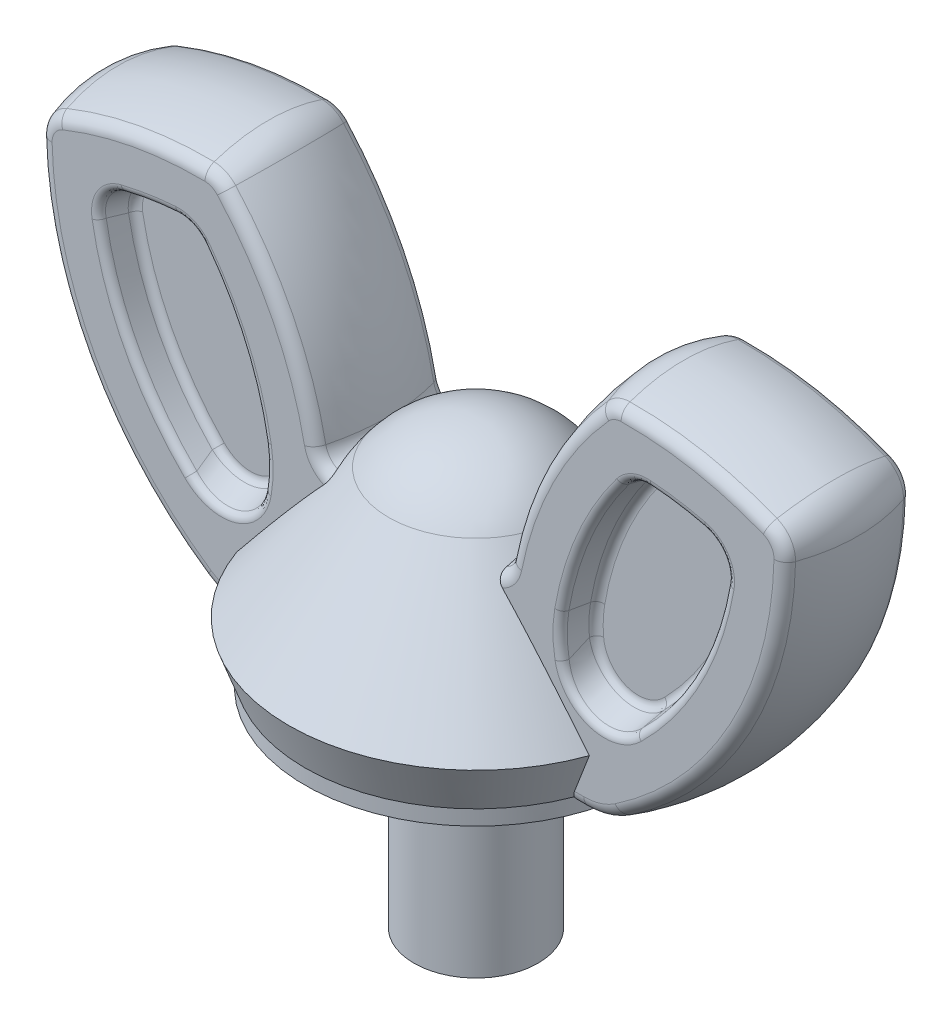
SolidWorks part; units mm, degrees
ref_plane "Front Plane" through (0, 0, 0) normal (0, 0, 1) x (1, 0, 0)
ref_plane "Top Plane" through (0, 0, 0) normal (0, 1, 0) x (1, 0, 0)
ref_plane "Right Plane" through (0, 0, 0) normal (1, 0, 0) x (0, 0, -1)
sketch "Sketch1" plane through (0, 0, 0) normal (0, 0, 1) x (1, 0, 0)
  line L0 (0, 10.7344) -> (0, 0) construction
  line L5 (4.826, 0) -> (-4.826, 0)
  line L6 (2.413, 5.08) -> (-2.413, 5.08)
  arc A11 (-2.413, 5.08) -> (-5.3975, 10.9034) centre (-13.1787, 3.2391) ccw
  arc A13 (-5.3975, 10.9034) -> (-10.795, 9.8298) centre (-6.0342, 0) ccw
  arc A24 (-10.795, 9.8298) -> (-6.0486, 0.3742) centre (0, 9.3295) ccw
  arc A26 (-4.826, 0) -> (-6.0486, 0.3742) centre (-4.826, 2.1844) cw
  arc A29 (4.826, 0) -> (6.0486, 0.3742) centre (4.826, 2.1844) ccw
  arc A34 (10.795, 9.8298) -> (6.0486, 0.3742) centre (0, 9.3295) cw
  arc A36 (5.3975, 10.9034) -> (10.795, 9.8298) centre (6.0342, 0) cw
  arc A37 (2.413, 5.08) -> (5.3975, 10.9034) centre (13.1787, 3.2391) cw
  point P19 (0, 0)
  point P27 (0, 5.08)
  point P29 (0, 5.08)
  point P44 (0, 5.08)
extrude "Extrude1" add sketch "Sketch1" along normal mid plane 3.556
fillet "Fillet4" radius 1.0922 4 edges at (10.795, 9.8298, 0) (5.3975, 10.9034, 0) (-5.3975, 10.9034, 0) (-10.795, 9.8298, 0)
sketch "Sketch2" plane through (0, 0, 1.778) normal (0, 0, 1) x (1, 0, 0)
  line L0 (0, 0) -> (0, 12.8329) construction
  line L1 (-4.826, 0) -> (4.826, 0) construction
  arc A10 (-4.1864, 4.7767) -> (-5.0416, 1.8652) centre (-7.5893, 4.1949) cw
  arc A11 (4.1864, 4.7767) -> (6.2055, 9.1212) centre (13.1787, 3.2391) cw
  arc A12 (6.2055, 9.1212) -> (8.9805, 8.634) centre (6.0342, 0) cw
  arc A13 (8.9805, 8.634) -> (5.0416, 1.8652) centre (0, 9.3295) cw
  arc A14 (4.1864, 4.7767) -> (5.0416, 1.8652) centre (7.5893, 4.1949) ccw
  arc A15 (-8.9805, 8.634) -> (-5.0416, 1.8652) centre (0, 9.3295) ccw
  arc A16 (-6.2055, 9.1212) -> (-8.9805, 8.634) centre (-6.0342, 0) ccw
  arc A17 (-4.1864, 4.7767) -> (-6.2055, 9.1212) centre (-13.1787, 3.2391) ccw
  arc A18 (-8.9805, 8.634) -> (-5.0416, 1.8652) centre (0, 9.3295) ccw
  arc A19 (-6.2055, 9.1212) -> (-8.9805, 8.634) centre (-6.0342, 0) ccw
  arc A20 (-4.1864, 4.7767) -> (-6.2055, 9.1212) centre (-13.1787, 3.2391) ccw
extrude "Cut-Extrude1" cut sketch "Sketch2" against normal blind 0.889 draft 10
fillet "Fillet1" radius 0.889 4 edges
fillet "Fillet6" radius 1.2446 2 edges
fillet "Fillet5" radius 0.3641 2 edges at (2.413, 5.08, 0) (-2.413, 5.08, 0)
fillet "Fillet3" radius 0.2223 28 edges at (7.4585, 9.011, 1.778) (7.4007, 8.8613, 0.889) (6.4621, 8.9114, 0.889) (8.6146, 8.3041, 0.889) (7.8855, 5.3103, 0.889) (4.2988, 4.3764, 0.889) (6.1282, 8.9579, 1.778) (8.7221, 8.5339, 1.778) (7.9776, 5.1471, 1.778) (4.1377, 4.1292, 1.778) (-4.2988, 4.3764, 0.889) (-7.8855, 5.3103, 0.889) (-8.5332, 8.4279, 0.889) (-7.4007, 8.8613, 0.889) (-6.1942, 8.7899, 0.889) (-4.1377, 4.1292, 1.778) (-7.9776, 5.1471, 1.778) (-8.7866, 8.4358, 1.778) (-7.4585, 9.011, 1.778) (-6.3795, 9.0717, 1.778) (4.9351, 6.7652, 0.889) (4.81, 6.8709, 1.778) (-4.9351, 6.7652, 0.889) (-4.81, 6.8709, 1.778) (4.9742, 2.938, 0.889) (5.0791, 2.5366, 1.778) (-5.2102, 2.8514, 0.889) (-5.0131, 2.5568, 1.778)
mirror "Mirror1" about plane through (0, 0, 0) normal (0, 0, 1) of "Fillet6", "Fillet3", "Fillet1", "Cut-Extrude1"
sketch "Sketch4" plane through (0, 0, 0) normal (1, 0, 0) x (0, 0, -1)
  line L1 (-1.778, 5.334) -> (1.778, 5.334)
  line L2 (-1.778, 4.4704) -> (-1.778, 5.334)
  line L4 (1.778, 0.3742) -> (1.778, 9.0918) construction
  line L6 (-1.778, 9.0918) -> (-1.778, 0.3742) construction
  line L7 (0, 5.715) -> (0, 0.381) construction
  line L9 (1.778, 4.4704) -> (1.778, 5.334)
  line L10 (-1.778, 5.08) -> (1.778, 5.08) construction
  arc A0 (-1.524, 4.826) -> (-1.778, 4.4704) centre (-1.4021, 4.4704) ccw
  arc A1 (1.524, 4.826) -> (-1.524, 4.826) centre (0, 0.381) ccw
  arc A2 (1.524, 4.826) -> (1.778, 4.4704) centre (1.4021, 4.4704) cw
  point P8 (0, 5.08)
sketch3d "3DSketch1"
  line L2 (-2.1102, 5.08, 1.778) -> (2.1102, 5.08, 1.778)
  line L3 (4.826, 0, 1.778) -> (-4.826, 0, 1.778)
  line L4 (-2.1102, 5.08, 1.778) -> (2.1102, 5.08, 1.778)
  line L5 (4.826, 0, 1.778) -> (-4.826, 0, 1.778)
  arc A15 (10.804, 9.0918, 1.778) -> (6.0486, 0.3742, 1.778) centre (0, 9.3295, 1.778) ccw
  arc A16 (10.1207, 10.1287, 1.778) -> (10.804, 9.0918, 1.778) centre (9.712, 9.1158, 1.778) ccw
  arc A17 (5.8682, 10.9207, 1.778) -> (10.1207, 10.1287, 1.778) centre (6.0342, 0, 1.778) ccw
  arc A18 (5.0743, 10.5608, 1.778) -> (5.8682, 10.9207, 1.778) centre (5.8848, 9.8287, 1.778) ccw
  arc A19 (2.4672, 5.3729, 1.778) -> (5.0743, 10.5608, 1.778) centre (13.1787, 3.2391, 1.778) ccw
  arc A20 (2.1102, 5.08, 1.778) -> (2.4672, 5.3729, 1.778) centre (2.1102, 5.4441, 1.778) ccw
  arc A21 (2.1102, 5.08, 1.778) -> (2.4672, 5.3729, 1.778) centre (2.1102, 5.4441, 1.778) ccw
  arc A22 (-5.0743, 10.5608, 1.778) -> (-2.4672, 5.3729, 1.778) centre (-13.1787, 3.2391, 1.778) ccw
  arc A23 (-5.8682, 10.9207, 1.778) -> (-5.0743, 10.5608, 1.778) centre (-5.8848, 9.8287, 1.778) ccw
  arc A24 (-10.1207, 10.1287, 1.778) -> (-5.8682, 10.9207, 1.778) centre (-6.0342, 0, 1.778) ccw
  arc A25 (-10.804, 9.0918, 1.778) -> (-10.1207, 10.1287, 1.778) centre (-9.712, 9.1158, 1.778) ccw
  arc A26 (-6.0486, 0.3742, 1.778) -> (-10.804, 9.0918, 1.778) centre (0, 9.3295, 1.778) ccw
  arc A27 (-4.826, 0, 1.778) -> (-6.0486, 0.3742, 1.778) centre (-4.826, 2.1844, 1.778) ccw
  arc A28 (6.0486, 0.3742, 1.778) -> (4.826, 0, 1.778) centre (4.826, 2.1844, 1.778) ccw
  arc A29 (10.804, 9.0918, 1.778) -> (6.0486, 0.3742, 1.778) centre (0, 9.3295, 1.778) ccw
  arc A30 (10.1207, 10.1287, 1.778) -> (10.804, 9.0918, 1.778) centre (9.712, 9.1158, 1.778) ccw
  arc A31 (5.8682, 10.9207, 1.778) -> (10.1207, 10.1287, 1.778) centre (6.0342, 0, 1.778) ccw
  arc A32 (5.0743, 10.5608, 1.778) -> (5.8682, 10.9207, 1.778) centre (5.8848, 9.8287, 1.778) ccw
  arc A33 (2.4672, 5.3729, 1.778) -> (5.0743, 10.5608, 1.778) centre (13.1787, 3.2391, 1.778) ccw
  arc A34 (-2.4672, 5.3729, 1.778) -> (-2.1102, 5.08, 1.778) centre (-2.1102, 5.4441, 1.778) ccw
  arc A35 (-2.4672, 5.3729, 1.778) -> (-2.1102, 5.08, 1.778) centre (-2.1102, 5.4441, 1.778) ccw
  arc A36 (-5.0743, 10.5608, 1.778) -> (-2.4672, 5.3729, 1.778) centre (-13.1787, 3.2391, 1.778) ccw
  arc A37 (-5.8682, 10.9207, 1.778) -> (-5.0743, 10.5608, 1.778) centre (-5.8848, 9.8287, 1.778) ccw
  arc A38 (-10.1207, 10.1287, 1.778) -> (-5.8682, 10.9207, 1.778) centre (-6.0342, 0, 1.778) ccw
  arc A39 (-10.804, 9.0918, 1.778) -> (-10.1207, 10.1287, 1.778) centre (-9.712, 9.1158, 1.778) ccw
  arc A40 (-6.0486, 0.3742, 1.778) -> (-10.804, 9.0918, 1.778) centre (0, 9.3295, 1.778) ccw
  arc A41 (-4.826, 0, 1.778) -> (-6.0486, 0.3742, 1.778) centre (-4.826, 2.1844, 1.778) ccw
  arc A42 (6.0486, 0.3742, 1.778) -> (4.826, 0, 1.778) centre (4.826, 2.1844, 1.778) ccw
  point P3 (2.1102, 5.4441, 2.1421)
  point P5 (2.1102, 5.4441, 2.1421)
  point P11 (-2.1102, 5.4441, 2.1421)
  point P13 (-2.1102, 5.4441, 2.1421)
  point P43 (0, 9.3295, -9.0286)
  point P46 (9.712, 9.1158, 0.6858)
  point P48 (6.0342, 0, -9.144)
  point P50 (5.8848, 9.8287, 0.6858)
  point P52 (13.1787, 3.2391, -9.144)
  point P58 (-13.1787, 3.2391, -9.144)
  point P60 (-5.8848, 9.8287, 0.6858)
  point P62 (-6.0342, 0, -9.144)
  point P64 (-9.712, 9.1158, 0.6858)
  point P66 (0, 9.3295, -9.0286)
  point P68 (-4.826, 2.1844, -0.4064)
  point P70 (4.826, 2.1844, -0.4064)
  point P71 (0, 9.3295, -9.0286)
  point P72 (9.712, 9.1158, 0.6858)
  point P73 (6.0342, 0, -9.144)
  point P74 (5.8848, 9.8287, 0.6858)
  point P75 (13.1787, 3.2391, -9.144)
  point P78 (-13.1787, 3.2391, -9.144)
  point P79 (-5.8848, 9.8287, 0.6858)
  point P80 (-6.0342, 0, -9.144)
  point P81 (-9.712, 9.1158, 0.6858)
  point P82 (0, 9.3295, -9.0286)
  point P83 (-4.826, 2.1844, -0.4064)
  point P84 (4.826, 2.1844, -0.4064)
  dimension "D1" = 0
sweep "Cut-Sweep2" cut profiles "Sketch4" path "3DSketch1"
sketch "Sketch3" plane through (0, 0, 0) normal (0, 0, 1) x (1, 0, 0)
  line L0 (0, 6.5903) -> (0, -11.3525) construction
  line L1 (1.7526, 0) -> (4.826, 0)
  line L2 (5.2882, 1.6933) -> (2.4672, 5.3729)
  line L4 (1.7526, 0) -> (1.7526, -6.35)
  line L5 (1.7526, -6.35) -> (0, -6.35)
  line L6 (4.826, 0) -> (4.826, 0.4233)
  line L7 (0, 6.5903) -> (0, -6.35)
  line L8 (0, 6.5903) -> (-2.4754, 6.5903) construction
  line L9 (4.826, 0.4233) -> (5.2882, 1.6933)
  arc A1 (2.4672, 5.3729) -> (0, 6.5903) centre (0, 3.4814) ccw
revolve "Revolve1" add sketch "Sketch3" angle 360 about L0
sketch "Sketch6" plane through (0, 0, 0) normal (0, 0, 1) x (1, 0, 0)
  line L0 (0, 4.5862) -> (0, -8.8633) construction
  line L2 (1.7526, -6.35) -> (1.7526, 0) construction
  line L3 (-1.7526, -6.35) -> (1.7526, -6.35) construction
  line L4 (1.7526, -5.8881) -> (2.0066, -5.8881)
  line L5 (2.0066, -5.8881) -> (2.0066, -6.604)
  line L8 (2.0066, -6.604) -> (0, -6.604)
  line L9 (0, -6.604) -> (0, -6.35)
  arc A0 (0, -6.35) -> (1.7526, -5.8881) centre (0, -2.794) ccw
  dimension "D1" = 0.254
  dimension "R" = 3.556
  dimension "D2" = 0.254
revolve "Cut-Revolve11" cut sketch "Sketch6" angle 360 about L0
sketch "Sketch5" plane through (0, 0, 0) normal (0, 0, 1) x (1, 0, 0)
  line L0 (1.7526, -0.0254) -> (1.2802, -0.2982)
  line L1 (1.2802, -0.2982) -> (1.7526, -0.5709)
  line L2 (1.7526, -0.5709) -> (1.7526, -0.0254)
  line L3 (0, 0) -> (0, -7.7715) construction
  line L6 (1.2802, -0.2982) -> (1.2802, -1.0906) construction
revolve "Cut-Revolve10" [suppressed] cut sketch "Sketch5" angle 360 about L3
pattern_linear "LPattern10" [suppressed] count 8 spacing 0.7925 along (0, -1, 0)
equation "\"D5@Sketch1\" = \"E@Sketch1\" / 2"
equation "\"D1@Sketch1\" = \"A@Sketch1\" / 4"
equation "\"D3@Sketch1\" = \"B@Sketch1\" * 9 /  10"
equation "\"D4@Sketch1\" = \"B@Sketch1\""
equation "\"D2@Sketch1\" = \"D4@Sketch1\" / 5"
equation "\"D1@Cut-Extrude1\" = \"C@Extrude1\" / 4"
equation "\"D1@Fillet1\" = \"D1@Cut-Extrude1\""
equation "\"D1@Fillet3\" = \"D1@Cut-Extrude1\" / 4"
equation "\"D2@Sketch3\" = \"G@Sketch1\" / 4"
equation "\"D3@Sketch3\" = \"E@Sketch1\""
equation "\"D1@Sketch4\" = \"C@Extrude1\" / 14"
equation "\"D1@Sketch5\" = \"d1@Sketch3\""
equation "\"D2@Sketch5\" = \"THD_MINOR@Cosmetic Thread1\""
equation "\"D3@LPattern10\" = \"pitch@Sketch5\""
equation "\"D1@LPattern10\" = \"L@Sketch3\" / \"D3@LPattern10\""
equation "\"D1@Cosmetic Thread1\" = \"L@Sketch3\""
equation "\"D2@Sketch4\" = \"D1@Sketch4\""
equation "\"D4@Sketch3\" = \"D2@Sketch3\" / 3"
equation "\"D1@Fillet4\" = \"D2@Sketch1\" /2"
equation "\"D1@Sketch2\" = \"D1@Sketch1\" / 3"
equation "\"D1@Fillet5\" = \"D1@Fillet4\" / 3"
equation "\"D1@Fillet6\" = \"D1@Fillet1\" * 1.4"
